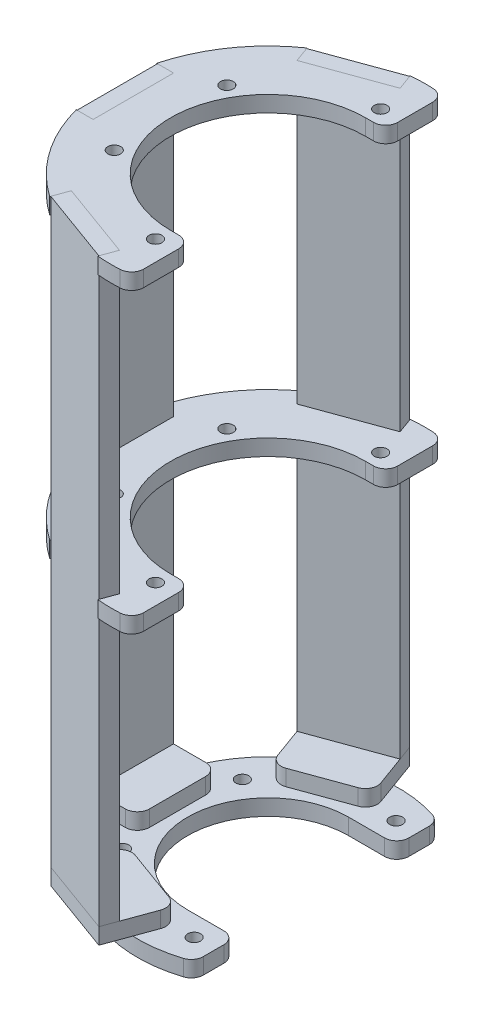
SolidWorks part; units mm, degrees
ref_plane "前视基准面" through (0, 0, 0) normal (0, 0, 1) x (1, 0, 0)
ref_plane "上视基准面" through (0, 0, 0) normal (0, 1, 0) x (1, 0, 0)
ref_plane "右视基准面" through (0, 0, 0) normal (1, 0, 0) x (0, 0, -1)
sketch "草图1" plane through (0, 0, 0) normal (0, 1, 0) x (1, 0, 0)
  line L0 (0, 24.25) -> (5, 24.25)
  line L2 (5, 24.25) -> (5, 38.6782)
  line L4 (-55.2961, 0) -> (37.9932, 0) construction
  line L8 (0, -24.25) -> (5, -24.25)
  line L9 (5, -24.25) -> (5, -38.6782)
  arc A1 (0, 24.25) -> (0, -24.25) centre (0, 0) ccw
  arc A2 (0, 40) -> (0, -40) centre (0, 0) ccw construction
  arc A3 (0, 40) -> (0, -40) centre (0, 0) ccw construction
  arc A4 (5, 38.6782) -> (5, -38.6782) centre (0, 0) ccw
  point P11 (-44, 0)
  dimension "D2" = 48.5
  dimension "D5" = 78
  dimension "D3" = 5
extrude "凸台-拉伸1" add sketch "草图1" against normal blind 4
sketch "草图2" plane through (0, 0, 0) normal (0, 1, 0) x (1, 0, 0)
  circle A0 centre (0, 28) radius 1.6
  circle A2 centre (-24.2487, 14) radius 1.6
  circle A4 centre (0, 28) radius 2.25 construction
  circle A6 centre (-24.2487, -14) radius 1.6
  circle A12 centre (0, 28) radius 2.25 construction
  circle A13 centre (-24.2487, 14) radius 2.25 construction
  circle A14 centre (-24.2487, 14) radius 2.25 construction
  circle A15 centre (-24.2487, -14) radius 2.25 construction
  circle A16 centre (-24.2487, -14) radius 2.25 construction
  circle A17 centre (0, -28) radius 2.25 construction
  circle A18 centre (0, -28) radius 2.25 construction
  circle A19 centre (0, -28) radius 1.6
  dimension "D1" = 3.2
extrude "切除-拉伸1" cut sketch "草图2" against normal blind 10
pattern_linear "阵列(线性)1" count 2 spacing 74 along (0, -1, 0)
sketch "草图3" plane through (0, -152.5, 0) normal (0, 1, 0) x (1, 0, 0)
  line L0 (0, 20) -> (12, 20)
  line L1 (0, -20) -> (12, -20)
  line L8 (12, 20) -> (12, 30.2035)
  line L11 (12, -30.2035) -> (12, -20)
  arc A0 (12, 30.2035) -> (12, -30.2035) centre (0, 0) ccw
  arc A1 (0, 20) -> (0, -20) centre (0, 0) ccw
  dimension "D2" = 65
  dimension "D3" = 40
  dimension "D1" = 12
extrude "凸台-拉伸2" add sketch "草图3" along normal blind 4 separate body
sketch "草图9" plane through (0, -148.5, 0) normal (0, 1, 0) x (1, 0, 0)
  line L0 (-27.5776, 23.1404) -> (-25.2795, 21.212) construction
  line L1 (-27.5776, 23.1404) -> (-24.8964, 20.8906)
  line L4 (-44.7457, 0) -> (25.6754, 0) construction
  line L6 (-27.5776, -23.1404) -> (-24.8964, -20.8906)
  line L7 (13, -29.7867) -> (5, -35.6511)
  line L8 (5, 24.25) -> (5, 35.6511) construction
  line L9 (13, 29.7867) -> (5, 35.6511)
  arc A0 (0, 36) -> (-27.5776, 23.1404) centre (0, 0) ccw construction
  arc A1 (5, 35.6511) -> (-27.5776, 23.1404) centre (0, 0) ccw
  arc A2 (13, 29.7867) -> (13, -29.7867) centre (0, 0) ccw construction
  arc A3 (13, 29.7867) -> (-24.8964, 20.8906) centre (0, 0) ccw
  arc A4 (13, -29.7867) -> (-24.8964, -20.8906) centre (0, 0) cw
  arc A5 (5, -35.6511) -> (-27.5776, -23.1404) centre (0, 0) cw
extrude "凸台-拉伸6" [suppressed] add sketch "草图9" against normal up to surface (6 mm away)
sketch "草图10" plane through (0, -148.5, 0) normal (0, -1, 0) x (1, 0, 0)
  line L2 (0, -36) -> (0, -33)
  line L3 (-25.2795, -21.212) -> (-27.5776, -23.1404)
  line L4 (0, -36) -> (0, -33)
  line L5 (-25.2795, -21.212) -> (-27.5776, -23.1404)
  line L6 (-27.5776, 23.1404) -> (-25.2795, 21.212)
  line L7 (0, 33) -> (0, 36)
  line L8 (-27.5776, 23.1404) -> (-25.2795, 21.212)
  line L9 (0, 33) -> (0, 36)
  arc A2 (-25.2795, -21.212) -> (0, -33) centre (0, 0) ccw
  arc A3 (-27.5776, -23.1404) -> (0, -36) centre (0, 0) ccw
  arc A4 (-25.2795, -21.212) -> (0, -33) centre (0, 0) ccw
  arc A5 (-27.5776, -23.1404) -> (0, -36) centre (0, 0) ccw
  arc A6 (0, 33) -> (-25.2795, 21.212) centre (0, 0) ccw
  arc A7 (0, 36) -> (-27.5776, 23.1404) centre (0, 0) ccw
  arc A8 (0, 33) -> (-25.2795, 21.212) centre (0, 0) ccw
  arc A9 (0, 36) -> (-27.5776, 23.1404) centre (0, 0) ccw
  dimension "D1" = 0
  dimension "D2" = 0
extrude "切除-拉伸3" cut sketch "草图10" against normal blind 4
sketch "草图12" plane through (0, -152.5, 0) normal (0, -1, 0) x (1, 0, 0)
  line L0 (-42.8806, 0) -> (33.2753, 0) construction
  line L1 (0, 0) -> (-35.1052, 24.5809) construction
  line L2 (0, 0) -> (6.7293, 25.1141) construction
  circle A0 centre (0, 0) radius 26 construction
  circle A1 centre (-21.298, 14.913) radius 1.6
  circle A2 centre (6.7293, 25.1141) radius 1.6
  circle A3 centre (6.7293, -25.1141) radius 1.6
  circle A4 centre (-21.298, -14.913) radius 1.6
  dimension "D1" = 52
  dimension "D3" = 3.2
  dimension "D2" = 35
  dimension "D4" = 75
extrude "切除-拉伸4" cut sketch "草图12" against normal up to surface (4 mm away)
fillet "圆角1" radius 3 2 edges at (12, -150.5, -20) (12, -150.5, 20)
fillet "圆角2" radius 3 2 edges at (5, -76, 24.25) (5, -76, -24.25)
fillet "圆角3" radius 3 2 edges at (5, -2, 24.25) (5, -2, -24.25)
sketch "草图13" plane through (0, 0, 0) normal (0, 1, 0) x (1, 0, 0)
  line L0 (-47.3766, 0) -> (25.4533, 0) construction
  line L1 (-37.6962, 10) -> (-33.5, 10)
  line L2 (-33.5, 10) -> (-33.5, -10)
  line L3 (-33.5, -10) -> (-37.6962, -10)
  arc A0 (5, 38.6782) -> (5, -38.6782) centre (0, 0) ccw construction
  arc A1 (-37.6962, 10) -> (-37.6962, -10) centre (0, 0) ccw
  point P10 (-39, 0)
  dimension "D1" = 5.5
  dimension "D2" = 20
  dimension "D3" = 4.1962
extrude "切除-拉伸5" cut sketch "草图13" against normal blind 100
pattern_circular "阵列(圆周)1" count 2 every 70 about axis through (0, 0, 0) along (0, 1, 0) of "切除-拉伸5"
sketch "草图14" plane through (-33.5, 0, 0) normal (-1, 0, 0) x (0, 0, 1)
  line L1 (-10, 0) -> (10, 0)
  line L2 (-10, 0) -> (-10, -144.4977)
  line L3 (-10, -144.4977) -> (10, -144.4977)
  line L4 (10, 0) -> (10, -144.4977)
  line L5 (32.5, -148.5) -> (-32.5, -148.5) construction
  dimension "D1" = 4.0023
extrude "凸台-拉伸7" add sketch "草图14" along normal blind 4 separate body
sketch "草图15" plane through (0, -144.4977, 0) normal (0, -1, 0) x (1, 0, 0)
  line L1 (-37.5, 10) -> (-22.5, 10)
  line L2 (-37.5, 10) -> (-37.5, -10)
  line L3 (-37.5, -10) -> (-22.5, -10)
  line L4 (-22.5, 10) -> (-22.5, -10)
  dimension "D1" = 15
extrude "凸台-拉伸8" add sketch "草图15" along normal blind 4 separate body
pattern_circular "阵列(圆周)2" count 2 every 70 about axis through (0, 0, 0) along (0, 1, 0)
fillet "圆角4" radius 3 2 edges at (5, -2, -38.6782) (5, -2, 38.6782)
fillet "圆角5" radius 3 2 edges at (5, -76, 38.6782) (5, -76, -38.6782)
fillet "圆角6" radius 3 2 edges at (12, -150.5, -30.2035) (12, -150.5, 30.2035)
fillet "圆角7" radius 3 2 edges at (-22.5, -146.4977, -10) (-22.5, -146.4977, 10)
fillet "圆角8" radius 3 2 edges at (1.7015, -146.4977, -24.5633) (-17.0924, -146.4977, -17.7229)
fillet "圆角9" radius 3 2 edges at (1.7015, -146.4977, 24.5633) (-17.0924, -146.4977, 17.7229)
